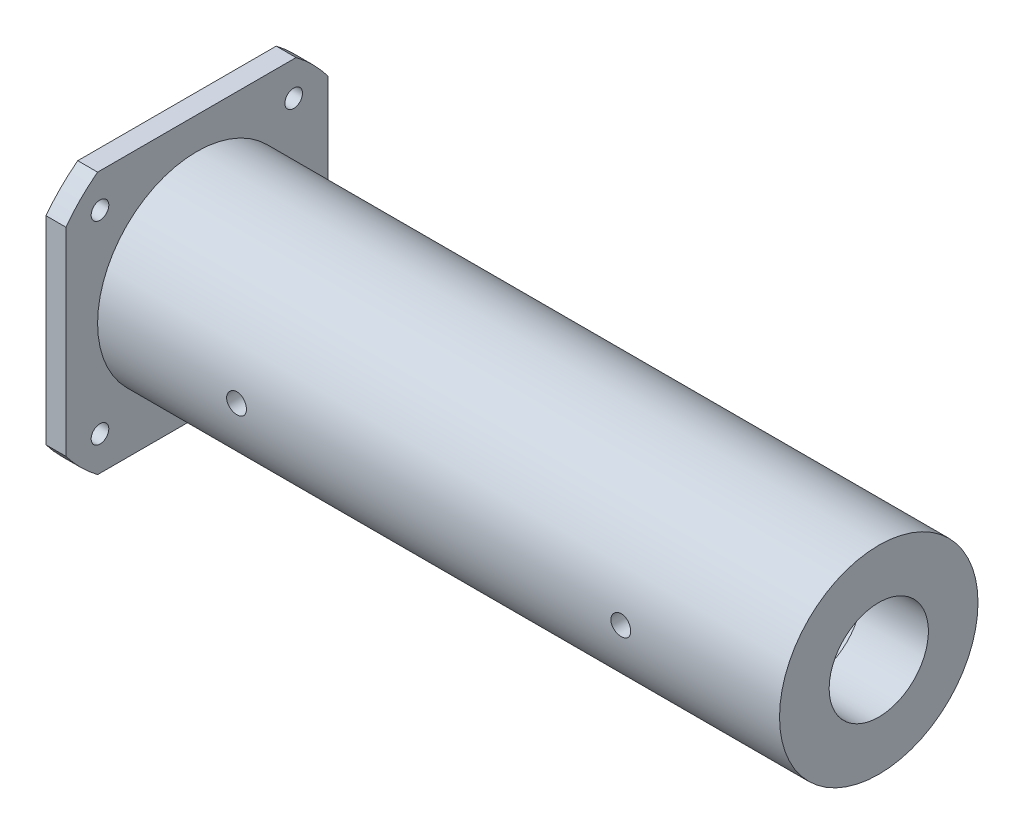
SolidWorks part; units mm, degrees
ref_plane "Plane1" through (0, 0, 0) normal (0, 0, 1) x (1, 0, 0)
ref_plane "Plane2" through (0, 0, 0) normal (0, 1, 0) x (1, 0, 0)
ref_plane "Plane3" through (0, 0, 0) normal (1, 0, 0) x (0, 0, -1)
sketch "Sketch1" plane through (0, 0, 0) normal (0, 0, 1) x (1, 0, 0)
  line L0 (0, 14.2748) -> (0, 26.289)
  line L1 (0, 26.289) -> (3.175, 26.289)
  line L2 (3.175, 26.289) -> (3.175, 15.875)
  line L3 (3.175, 15.875) -> (112.268, 15.875)
  line L4 (112.268, 15.875) -> (112.268, 7.9375)
  line L5 (112.268, 7.9375) -> (101.6, 7.9375)
  line L6 (101.6, 7.9375) -> (101.6, 14.2748)
  line L7 (101.6, 14.2748) -> (0, 14.2748)
  line L8 (0, 0) -> (100.426, 0) construction
  dimension "D1" = 26.289
  dimension "D2" = 112.268
  dimension "D3" = 3.175
  dimension "D4" = 14.2748
  dimension "D5" = 15.875
  dimension "D6" = 7.9375
  dimension "D7" = 101.6
  dimension "D8" = 112.268
revolve "Base-Revolve" add sketch "Sketch1" angle 360 about L8
sketch "Sketch2" plane through (0, 0, 0) normal (1, 0, 0) x (0, 0, -1)
  line L0 (-15.8745, 20.955) -> (15.8745, 20.955)
  line L1 (20.955, 15.8745) -> (20.955, -15.8745)
  line L2 (15.8745, -20.955) -> (-15.8745, -20.955)
  line L3 (-20.955, -15.8745) -> (-20.955, 15.8745)
  circle A0 centre (0, 0) radius 26.289 construction
  arc A1 (20.955, 15.8745) -> (15.8745, 20.955) centre (0, 0) ccw
  arc A2 (-15.8745, 20.955) -> (-20.955, 15.8745) centre (0, 0) ccw
  arc A3 (-20.955, -15.8745) -> (-15.8745, -20.955) centre (0, 0) ccw
  arc A4 (15.8745, -20.955) -> (20.955, -15.8745) centre (0, 0) ccw
  circle A5 centre (0, 0) radius 31.1584
  dimension "D5" = 62.3168
  dimension "D1" = 20.955
  dimension "D2" = 20.955
  dimension "D3" = 20.955
  dimension "D4" = 20.955
extrude "Cut-Extrude2" cut sketch "Sketch2" along normal through all
sketch "Sketch3" plane through (0, 0, 0) normal (1, 0, 0) x (0, 0, -1)
  circle A0 centre (-15.494, 15.5015) radius 1.4097
  circle A1 centre (15.494, 15.5015) radius 1.4097
  circle A2 centre (15.494, -15.494) radius 1.4097
  circle A3 centre (-15.494, -15.494) radius 1.4097
  dimension "D2" = 15.494
  dimension "D3" = 15.494
  dimension "D5" = 15.494
  dimension "D9" = 2.8194
  dimension "D1" = 15.494
  dimension "D4" = 15.494
  dimension "D6" = 15.5015
  dimension "D7" = 15.5015
  dimension "D8" = 15.494
extrude "Cut-Extrude4" cut sketch "Sketch3" along normal through all
ref_plane "Plane4" through (9.525, 0, 0) normal (1, 0, 0) x (0, 0, -1)
sketch "Sketch4" plane through (9.525, 0, 0) normal (1, 0, 0) x (0, 0, -1)
  line L0 (-12.7847, 6.35) -> (-11.176, 6.35)
  line L1 (-11.176, 6.35) -> (-11.176, -6.35)
  line L2 (-11.176, -6.35) -> (-12.7847, -6.35)
  circle A0 centre (0, 0) radius 14.2748 construction
  arc A1 (-12.7847, 6.35) -> (-12.7847, -6.35) centre (0, 0) ccw
  dimension "D1" = 6.35
  dimension "D2" = 6.35
  dimension "D3" = 11.176
extrude "Boss-Extrude1" add sketch "Sketch4" along normal blind 88.9
sketch "Sketch5" plane through (0, 0, 0) normal (0, 0, 1) x (1, 0, 0)
  line L0 (0, 0) -> (25.4, 0) construction
  line L1 (0, 0) -> (100.426, 0) construction
  line L2 (112.268, -15.875) -> (112.268, 15.875) construction
  circle A0 centre (25.4, 0) radius 1.5875
  circle A1 centre (86.868, 0) radius 1.5875
  dimension "D1" = 3.175
  dimension "D2" = 25.4
  dimension "D3" = 25.4
extrude "Cut-Extrude5" cut sketch "Sketch5" against normal through all and the other way through all
